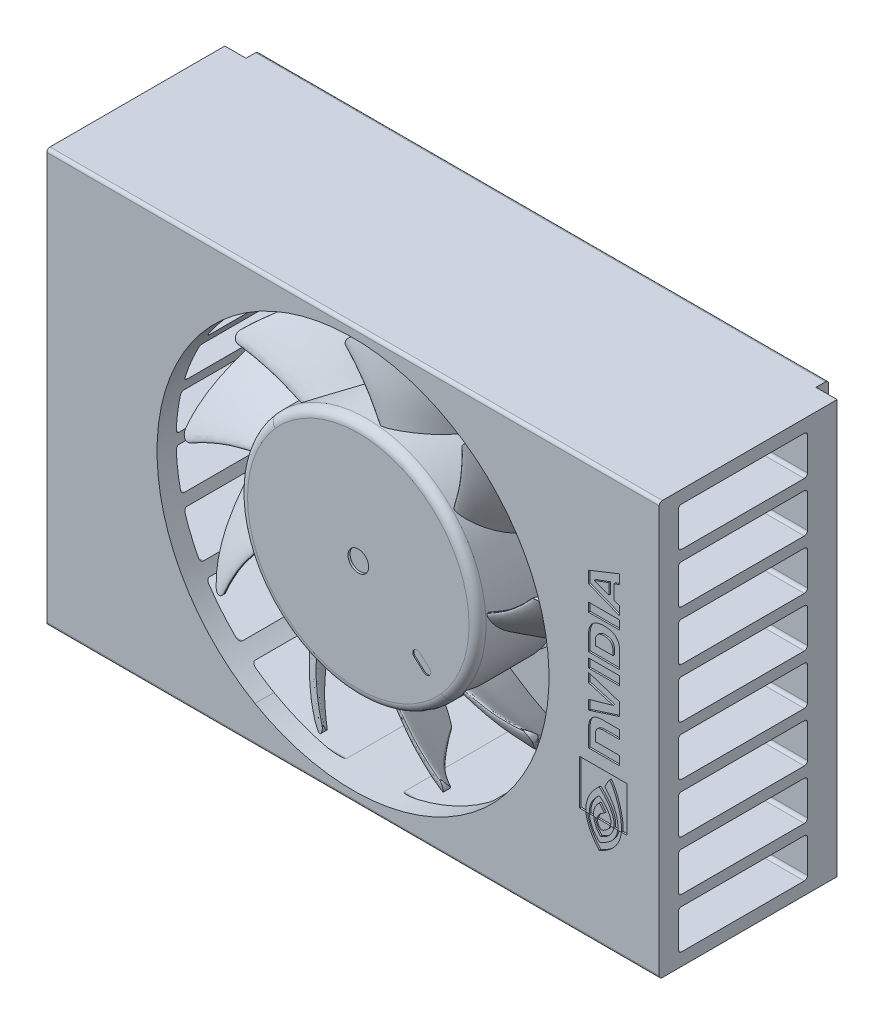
SolidWorks part; units mm, degrees
ref_plane "Front Plane" through (0, 0, 0) normal (0, 0, 1) x (1, 0, 0)
ref_plane "Top Plane" through (0, 0, 0) normal (0, 1, 0) x (1, 0, 0)
ref_plane "Right Plane" through (0, 0, 0) normal (1, 0, 0) x (0, 0, -1)
imported_body "3514_ASM_1112_ASM.stp-1/3514_ASM_2_ASM.stp-1/3514_18.stp-1-solid1"
imported_body "3514_ASM_1112_ASM.stp-1/3514_ASM_2_ASM.stp-1/3514-IMPELLER-J441-346-2_6.stp-1-solid1"
imported_body "095-0073-000_HEATSINK_P3518.stp-1-solid1"
imported_body "M1_6_0_35PITX4MM_MACHINE.stp-1-solid1"
imported_body "M1_6_0_35PITX4MM_MACHINE.stp-2-solid1"
imported_body "M1_6_0_35PITX4MM_MACHINE.stp-3-solid1"
sketch "草图1" plane through (0, 0, 3.5) normal (0, 0, -1) x (-1, 0, 0)
  line L0 (-61.7, 19.1) -> (-3.9, 19.1) construction
  line L1 (-61.7, -0.4) -> (-61.7, 38.6) construction
  line L2 (-3.9, 38.6) -> (-3.9, -0.4) construction
  line L3 (-47.8, 19.1) -> (-17.8, 19.1) construction
  circle A0 centre (-47.8, 19.1) radius 2
  circle A1 centre (-17.8, 19.1) radius 2
  point P9 (-32.8, 19.1)
extrude "切除-拉伸1" cut sketch "草图1" against normal blind 1 contours A0 | A1
